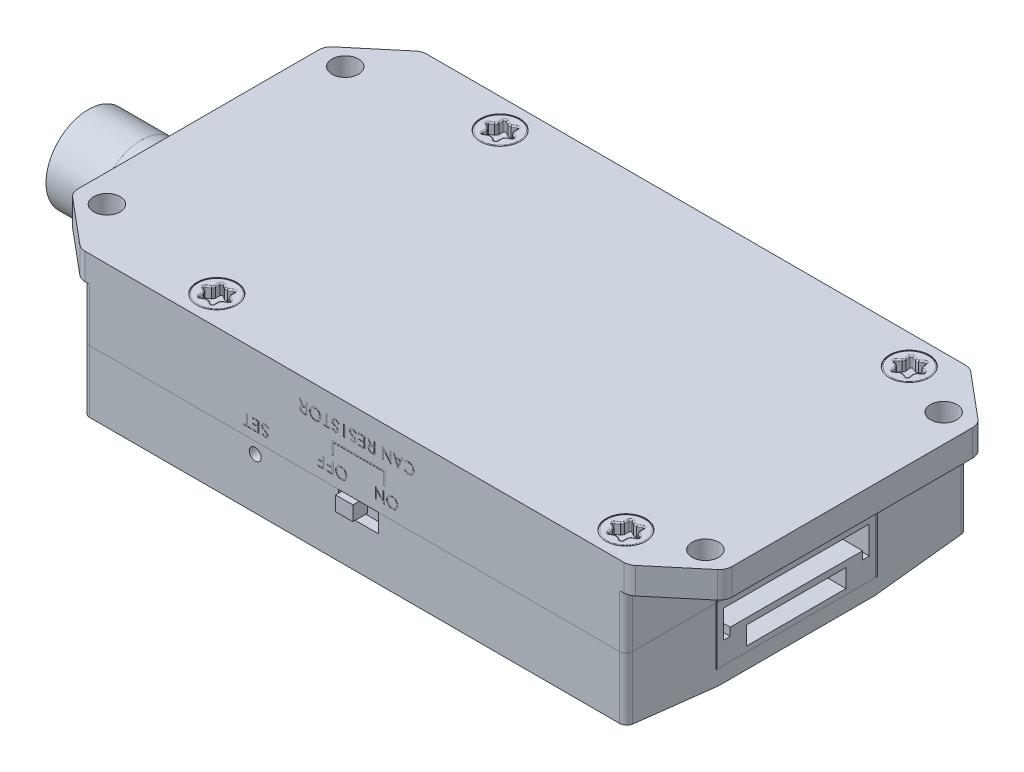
SolidWorks part; units mm, degrees
ref_plane "前视基准面" through (0, 0, 0) normal (0, 0, 1) x (1, 0, 0)
ref_plane "上视基准面" through (0, 0, 0) normal (0, 1, 0) x (1, 0, 0)
ref_plane "右视基准面" through (0, 0, 0) normal (1, 0, 0) x (0, 0, -1)
imported_body "6_1-1-surface1"
imported_body "7_1-1-surface1"
imported_body "7_1-1-surface2"
imported_body "7_1-1-surface3"
imported_body "7_1-1-surface4"
imported_body "7_1-1-surface5"
imported_body "7_1-1-surface6"
imported_body "7_1-1-surface7"
imported_body "7_1-1-surface8"
imported_body "7_1-1-surface9"
imported_body "8_1-1-surface1"
imported_body "8_1-1-surface2"
imported_body "2_1-1-surface1"
imported_body "2_1-1-surface2"
imported_body "2_1-1-surface3"
imported_body "2_1-1-surface4"
imported_body "2_1-1-surface5"
imported_body "2_1-1-surface6"
imported_body "2_1-1-surface7"
imported_body "2_1-1-surface8"
imported_body "2_1-1-surface9"
imported_body "2_1-1-surface10"
imported_body "5_1-1-surface1"
imported_body "5_1-2-surface1"
imported_body "5_1-3-surface1"
imported_body "5_1-4-surface1"
sketch "草图1" plane through (0, 5.4, 0) normal (0, 1, 0) x (1, 0, 0)
  line L0 (-13, 13.9) -> (-13, 15.9)
  line L1 (-17, 13.9) -> (10, 13.9)
  line L2 (-17, 13.9) -> (-17, 17.9)
  line L3 (-17, 17.9) -> (10, 17.9)
  line L4 (10, 13.9) -> (10, 17.9)
  line L5 (-13, 15.9) -> (6, 15.9)
  line L6 (6, 15.9) -> (6, 13.9)
  dimension "D1" = 4
  dimension "D2" = 13.9
  dimension "D3" = 17
  dimension "D4" = 10
  dimension "D5" = 4
  dimension "D6" = 4
  dimension "D7" = 2
sketch "草图2" plane through (-30.7, 0, 0) normal (-1, 0, 0) x (0, 0, 1)
  circle A0 centre (0, -1.3) radius 3.2 construction
  circle A1 centre (0, -1.3) radius 3.2
extrude "凸台-拉伸1" add sketch "草图2" along normal blind 4
